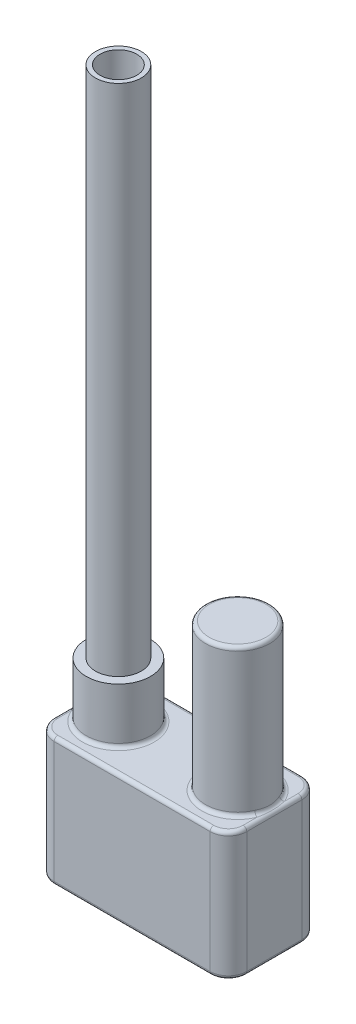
SolidWorks part; units mm, degrees
ref_plane "Face" through (0, 0, 0) normal (0, 0, 1) x (1, 0, 0)
ref_plane "Dessus" through (0, 0, 0) normal (0, 1, 0) x (1, 0, 0)
ref_plane "Droite" through (0, 0, 0) normal (1, 0, 0) x (0, 0, -1)
sketch "Esquisse1" plane through (0, 0, 0) normal (0, 0, 1) x (1, 0, 0)
  line L1 (-105, 0) -> (0, 0)
  line L2 (-105, 0) -> (-105, -70)
  line L3 (-105, -70) -> (0, -70)
  line L4 (0, 0) -> (0, -70)
  dimension "D1" = 105
  dimension "D2" = 70
extrude "Base-Extrusion" add sketch "Esquisse1" along normal blind 50
sketch "Esquisse2" plane through (0, 0, 0) normal (0, 1, 0) x (-1, 0, 0)
  line L0 (0, 50) -> (0, 0) construction
  line L1 (0, 50) -> (105, 50) construction
  line L2 (-25.6385, 25) -> (5.3593, 25) construction
  line L3 (0, 0) -> (105, 0) construction
  circle A0 centre (20, 25) radius 17.5
  circle A1 centre (85, 25) radius 17.5
  dimension "D1" = 35
  dimension "D3" = 65
  dimension "D2" = 20
extrude "Boss.-Extru.1" add sketch "Esquisse2" along normal blind 30
sketch "Esquisse3" plane through (0, 30, 0) normal (0, 1, 0) x (-1, 0, 0)
  circle A0 centre (20, 25) radius 17.5
  circle A1 centre (20, 25) radius 17.5 construction
extrude "Boss.-Extru.2" add sketch "Esquisse3" along normal blind 50
sketch "Esquisse5" plane through (0, 30, 0) normal (0, 1, 0) x (-1, 0, 0)
  circle A0 centre (85, 25) radius 12.5
  dimension "D1" = 25
extrude "Boss.-Extru.-Mince1" add sketch "Esquisse5" along normal blind 280 thin
ref_plane "Plan1" through (-85, 0, 0) normal (1, 0, 0) x (0, 0, -1)
fillet "Congé1" radius 10
fillet "Congé2" radius 10
fillet "Congé3" radius 2
fillet "Congé4" radius 2
fillet "Congé5" radius 2
fillet "Congé6" radius 2
